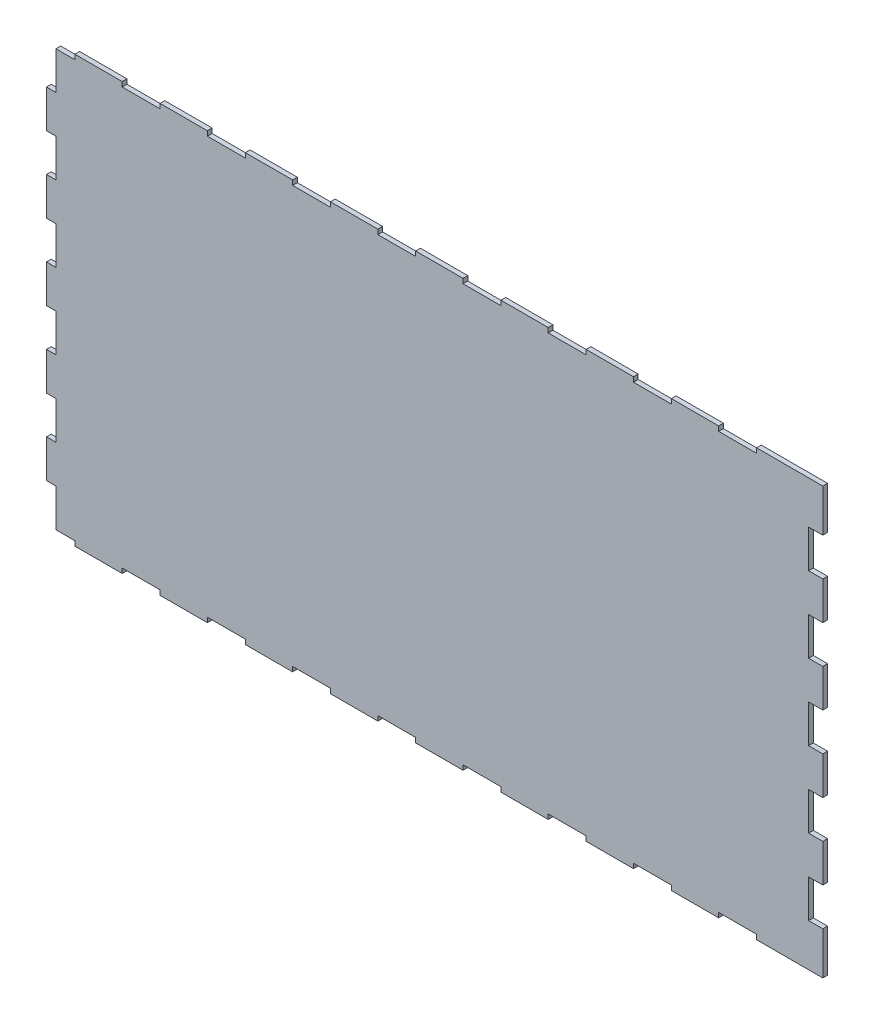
SolidWorks part; units mm, degrees
ref_plane "Front Plane" through (0, 0, 0) normal (0, 0, 1) x (1, 0, 0)
ref_plane "Top Plane" through (0, 0, 0) normal (0, 1, 0) x (1, 0, 0)
ref_plane "Right Plane" through (0, 0, 0) normal (1, 0, 0) x (0, 0, -1)
sketch "Model" plane through (0, 0, 0) normal (0, 0, 1) x (1, 0, 0)
  line L0 (900, 180) -> (885, 180)
  line L1 (885, 140) -> (885, 180)
  line L2 (900, 140) -> (885, 140)
  line L3 (900, 100) -> (900, 140)
  line L4 (900, 100) -> (885, 100)
  line L5 (885, 60) -> (885, 100)
  line L6 (900, 60) -> (885, 60)
  line L7 (900, 20) -> (900, 60)
  line L8 (900, 20) -> (885, 20)
  line L9 (885, -20) -> (885, 20)
  line L10 (900, -20) -> (885, -20)
  line L11 (900, -60) -> (900, -20)
  line L12 (900, -60) -> (885, -60)
  line L13 (885, -100) -> (885, -60)
  line L14 (900, -100) -> (885, -100)
  line L15 (900, -140) -> (900, -100)
  line L16 (900, -140) -> (885, -140)
  line L17 (885, -180) -> (885, -140)
  line L18 (900, -180) -> (885, -180)
  line L19 (900, -225) -> (900, -180)
  line L20 (900, -225) -> (830, -225)
  line L21 (830, -225) -> (830, -220)
  line L22 (830, -220) -> (790, -220)
  line L23 (790, -220) -> (790, -225)
  line L24 (790, -225) -> (740, -225)
  line L25 (740, -225) -> (740, -220)
  line L26 (740, -220) -> (700, -220)
  line L27 (700, -220) -> (700, -225)
  line L28 (700, -225) -> (650, -225)
  line L29 (650, -225) -> (650, -220)
  line L30 (650, -220) -> (610, -220)
  line L31 (610, -220) -> (610, -225)
  line L32 (610, -225) -> (560, -225)
  line L33 (560, -225) -> (560, -220)
  line L34 (560, -220) -> (520, -220)
  line L35 (520, -220) -> (520, -225)
  line L36 (520, -225) -> (470, -225)
  line L37 (470, -225) -> (470, -220)
  line L38 (470, -220) -> (430, -220)
  line L39 (430, -220) -> (430, -225)
  line L40 (430, -225) -> (380, -225)
  line L41 (380, -225) -> (380, -220)
  line L42 (380, -220) -> (340, -220)
  line L43 (340, -220) -> (340, -225)
  line L44 (340, -225) -> (290, -225)
  line L45 (290, -225) -> (290, -220)
  line L46 (290, -220) -> (250, -220)
  line L47 (250, -220) -> (250, -225)
  line L48 (250, -225) -> (200, -225)
  line L49 (200, -225) -> (200, -220)
  line L50 (200, -220) -> (160, -220)
  line L51 (160, -220) -> (160, -225)
  line L52 (160, -225) -> (110, -225)
  line L53 (110, -225) -> (110, -220)
  line L54 (110, -220) -> (70, -220)
  line L55 (70, -220) -> (70, -225)
  line L56 (70, -225) -> (20, -225)
  line L57 (20, -225) -> (20, -220)
  line L58 (20, -220) -> (-20, -220)
  line L59 (-20, -220) -> (-20, -225)
  line L60 (-20, -225) -> (-70, -225)
  line L61 (-70, -225) -> (-70, -220)
  line L62 (-70, -220) -> (-110, -220)
  line L63 (-110, -220) -> (-110, -225)
  line L64 (-110, -225) -> (-160, -225)
  line L65 (-160, -225) -> (-160, -220)
  line L66 (-160, -220) -> (-200, -220)
  line L67 (-200, -220) -> (-200, -225)
  line L68 (-200, -225) -> (-250, -225)
  line L69 (-250, -225) -> (-250, -220)
  line L70 (-250, -220) -> (-290, -220)
  line L71 (-290, -220) -> (-290, -225)
  line L72 (-290, -225) -> (-340, -225)
  line L73 (-340, -225) -> (-340, -220)
  line L74 (-340, -220) -> (-380, -220)
  line L75 (-380, -220) -> (-380, -225)
  line L76 (-380, -225) -> (-430, -225)
  line L77 (-430, -225) -> (-430, -220)
  line L78 (-430, -220) -> (-470, -220)
  line L79 (-470, -220) -> (-470, -225)
  line L80 (-470, -225) -> (-520, -225)
  line L81 (-520, -225) -> (-520, -220)
  line L82 (-520, -220) -> (-560, -220)
  line L83 (-560, -220) -> (-560, -225)
  line L84 (-560, -225) -> (-610, -225)
  line L85 (-610, -225) -> (-610, -220)
  line L86 (-610, -220) -> (-650, -220)
  line L87 (-650, -220) -> (-650, -225)
  line L88 (-650, -225) -> (-700, -225)
  line L89 (-700, -225) -> (-700, -220)
  line L90 (-700, -220) -> (-740, -220)
  line L91 (-740, -220) -> (-740, -225)
  line L92 (-740, -225) -> (-790, -225)
  line L93 (-790, -225) -> (-790, -220)
  line L94 (-790, -220) -> (-830, -220)
  line L95 (-830, -220) -> (-830, -225)
  line L96 (-830, -225) -> (-900, -225)
  line L97 (-900, -225) -> (-900, -180)
  line L98 (-900, -180) -> (-885, -180)
  line L99 (-885, -180) -> (-885, -140)
  line L100 (-900, -140) -> (-885, -140)
  line L101 (-900, -140) -> (-900, -100)
  line L102 (-900, -100) -> (-885, -100)
  line L103 (-885, -100) -> (-885, -60)
  line L104 (-900, -60) -> (-885, -60)
  line L105 (-900, -60) -> (-900, -20)
  line L106 (-900, -20) -> (-885, -20)
  line L107 (-885, -20) -> (-885, 20)
  line L108 (-900, 20) -> (-885, 20)
  line L109 (-900, 20) -> (-900, 60)
  line L110 (-900, 60) -> (-885, 60)
  line L111 (-885, 60) -> (-885, 100)
  line L112 (-900, 100) -> (-885, 100)
  line L113 (-900, 100) -> (-900, 140)
  line L114 (-900, 140) -> (-885, 140)
  line L115 (-885, 140) -> (-885, 180)
  line L116 (-900, 180) -> (-885, 180)
  line L117 (-900, 180) -> (-900, 225)
  line L118 (-830, 225) -> (-900, 225)
  line L119 (-830, 225) -> (-830, 220)
  line L120 (-790, 220) -> (-830, 220)
  line L121 (-790, 225) -> (-790, 220)
  line L122 (-740, 225) -> (-790, 225)
  line L123 (-740, 225) -> (-740, 220)
  line L124 (-700, 220) -> (-740, 220)
  line L125 (-700, 225) -> (-700, 220)
  line L126 (-650, 225) -> (-700, 225)
  line L127 (-650, 225) -> (-650, 220)
  line L128 (-610, 220) -> (-650, 220)
  line L129 (-610, 225) -> (-610, 220)
  line L130 (-560, 225) -> (-610, 225)
  line L131 (-560, 225) -> (-560, 220)
  line L132 (-520, 220) -> (-560, 220)
  line L133 (-520, 225) -> (-520, 220)
  line L134 (-470, 225) -> (-520, 225)
  line L135 (-470, 225) -> (-470, 220)
  line L136 (-430, 220) -> (-470, 220)
  line L137 (-430, 225) -> (-430, 220)
  line L138 (-380, 225) -> (-430, 225)
  line L139 (-380, 225) -> (-380, 220)
  line L140 (-340, 220) -> (-380, 220)
  line L141 (-340, 225) -> (-340, 220)
  line L142 (-290, 225) -> (-340, 225)
  line L143 (-290, 225) -> (-290, 220)
  line L144 (-250, 220) -> (-290, 220)
  line L145 (-250, 225) -> (-250, 220)
  line L146 (-200, 225) -> (-250, 225)
  line L147 (-200, 225) -> (-200, 220)
  line L148 (-160, 220) -> (-200, 220)
  line L149 (-160, 225) -> (-160, 220)
  line L150 (-110, 225) -> (-160, 225)
  line L151 (-110, 225) -> (-110, 220)
  line L152 (-70, 220) -> (-110, 220)
  line L153 (-70, 225) -> (-70, 220)
  line L154 (-20, 225) -> (-70, 225)
  line L155 (-20, 225) -> (-20, 220)
  line L156 (20, 220) -> (-20, 220)
  line L157 (20, 225) -> (20, 220)
  line L158 (70, 225) -> (20, 225)
  line L159 (70, 225) -> (70, 220)
  line L160 (110, 220) -> (70, 220)
  line L161 (110, 225) -> (110, 220)
  line L162 (160, 225) -> (110, 225)
  line L163 (160, 225) -> (160, 220)
  line L164 (200, 220) -> (160, 220)
  line L165 (200, 225) -> (200, 220)
  line L166 (250, 225) -> (200, 225)
  line L167 (250, 225) -> (250, 220)
  line L168 (290, 220) -> (250, 220)
  line L169 (290, 225) -> (290, 220)
  line L170 (340, 225) -> (290, 225)
  line L171 (340, 225) -> (340, 220)
  line L172 (380, 220) -> (340, 220)
  line L173 (380, 225) -> (380, 220)
  line L174 (430, 225) -> (380, 225)
  line L175 (430, 225) -> (430, 220)
  line L176 (470, 220) -> (430, 220)
  line L177 (470, 225) -> (470, 220)
  line L178 (520, 225) -> (470, 225)
  line L179 (520, 225) -> (520, 220)
  line L180 (560, 220) -> (520, 220)
  line L181 (560, 225) -> (560, 220)
  line L182 (610, 225) -> (560, 225)
  line L183 (610, 225) -> (610, 220)
  line L184 (650, 220) -> (610, 220)
  line L185 (650, 225) -> (650, 220)
  line L186 (700, 225) -> (650, 225)
  line L187 (700, 225) -> (700, 220)
  line L188 (740, 220) -> (700, 220)
  line L189 (740, 225) -> (740, 220)
  line L190 (790, 225) -> (740, 225)
  line L191 (790, 225) -> (790, 220)
  line L192 (830, 220) -> (790, 220)
  line L193 (830, 225) -> (830, 220)
  line L194 (900, 225) -> (830, 225)
  line L195 (900, 180) -> (900, 225)
extrude "Boss-Extrude1" add sketch "Model" along normal blind 5
sketch "Sketch1" plane through (0, 0, 5) normal (0, 0, 1) x (1, 0, 0)
  line L0 (90, 220) -> (90, 100)
  line L1 (90, -220) -> (-996.8117, -716.8685)
  line L2 (-996.8117, -716.8685) -> (-1055.8964, 587.3667)
  line L3 (0, 202.5) -> (0, 48.6535) construction
  line L4 (110, 220) -> (70, 220) construction
  line L5 (70, -220) -> (110, -220) construction
  line L6 (-1055.8964, 587.3667) -> (90, 220)
  line L7 (90, 180) -> (80, 180)
  line L8 (90, 180) -> (90, 140)
  line L9 (90, 140) -> (80, 140)
  line L10 (80, 180) -> (80, 140)
  line L13 (90, 60) -> (80, 60)
  line L14 (80, 100) -> (80, 60)
  line L15 (90, 100) -> (80, 100)
  line L16 (90, -20) -> (80, -20)
  line L17 (80, 20) -> (80, -20)
  line L18 (90, 20) -> (80, 20)
  line L19 (90, -100) -> (80, -100)
  line L20 (80, -60) -> (80, -100)
  line L21 (90, -60) -> (80, -60)
  line L22 (90, -180) -> (80, -180)
  line L23 (80, -140) -> (80, -180)
  line L24 (90, -140) -> (80, -140)
  line L25 (90, 60) -> (90, 20)
  line L26 (90, -20) -> (90, -60)
  line L27 (90, -100) -> (90, -140)
  line L28 (90, -180) -> (90, -220)
  dimension "D1" = 40
  dimension "D2" = 40
  dimension "D3" = 10
  dimension "D5" = 40
  dimension "D4" = 5
extrude "Cut-Extrude1" cut sketch "Sketch1" against normal through all contours L3 L6 L2 L1 | L6 L3 L1 L28 L22 L23 L24 L27 L19 L20 L21 L26 L16 L17 L18 L25 L13 L14 L15 L0 L9 L10 L7
